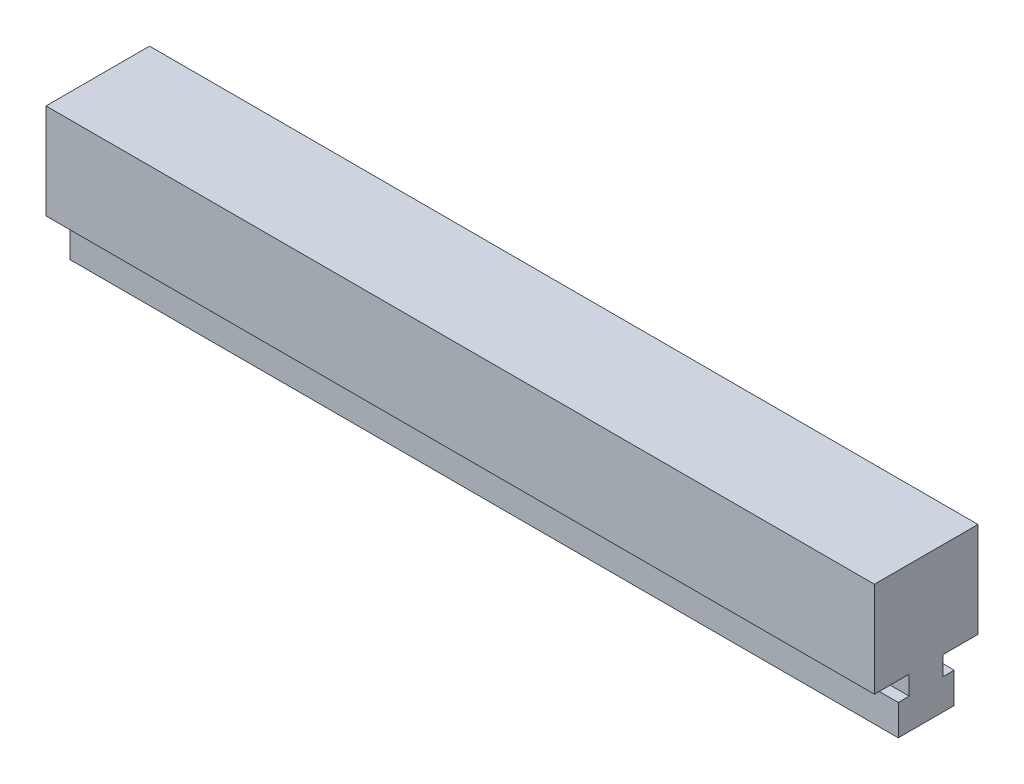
SolidWorks part; units mm, degrees
ref_plane "Front Plane" through (0, 0, 0) normal (0, 0, 1) x (1, 0, 0)
ref_plane "Top Plane" through (0, 0, 0) normal (0, 1, 0) x (1, 0, 0)
ref_plane "Right Plane" through (0, 0, 0) normal (1, 0, 0) x (0, 0, -1)
sketch3d "3DSketch1"
  line L0 (0, 0, 0) -> (200, 0, 0)
  dimension "D1" = 200
other "Liukukiskot 1.6033 LIUKUKISKO 23T(1)"
ref_plane "Plane1" through (0, 0, 0) normal (1, 0, 0) x (0, 0, -1)
sketch "Sketch1" plane through (0, 0, 0) normal (1, 0, 0) x (0, 0, -1)
  line L0 (12.8276, -5.6966) -> (12.8276, 17.3034)
  line L1 (12.8276, 17.3034) -> (-12.1724, 17.3034)
  line L2 (-12.1724, 17.3034) -> (-12.1724, -5.6966)
  line L3 (-12.1724, -5.6966) -> (-3.7724, -5.6966)
  line L4 (-3.7724, -5.6966) -> (-3.7724, -10.2965)
  line L5 (-3.7724, -10.2965) -> (-6.4224, -10.2965)
  line L6 (-6.4224, -10.2965) -> (-6.4224, -17.6966)
  line L7 (-6.4224, -17.6966) -> (7.0776, -17.6966)
  line L8 (7.0776, -17.6966) -> (7.0776, -10.2965)
  line L9 (7.0776, -10.2965) -> (4.4276, -10.2965)
  line L10 (4.4276, -10.2965) -> (4.4276, -5.6966)
  line L11 (4.4276, -5.6966) -> (12.8276, -5.6966)
  point P12 (0, 0)
